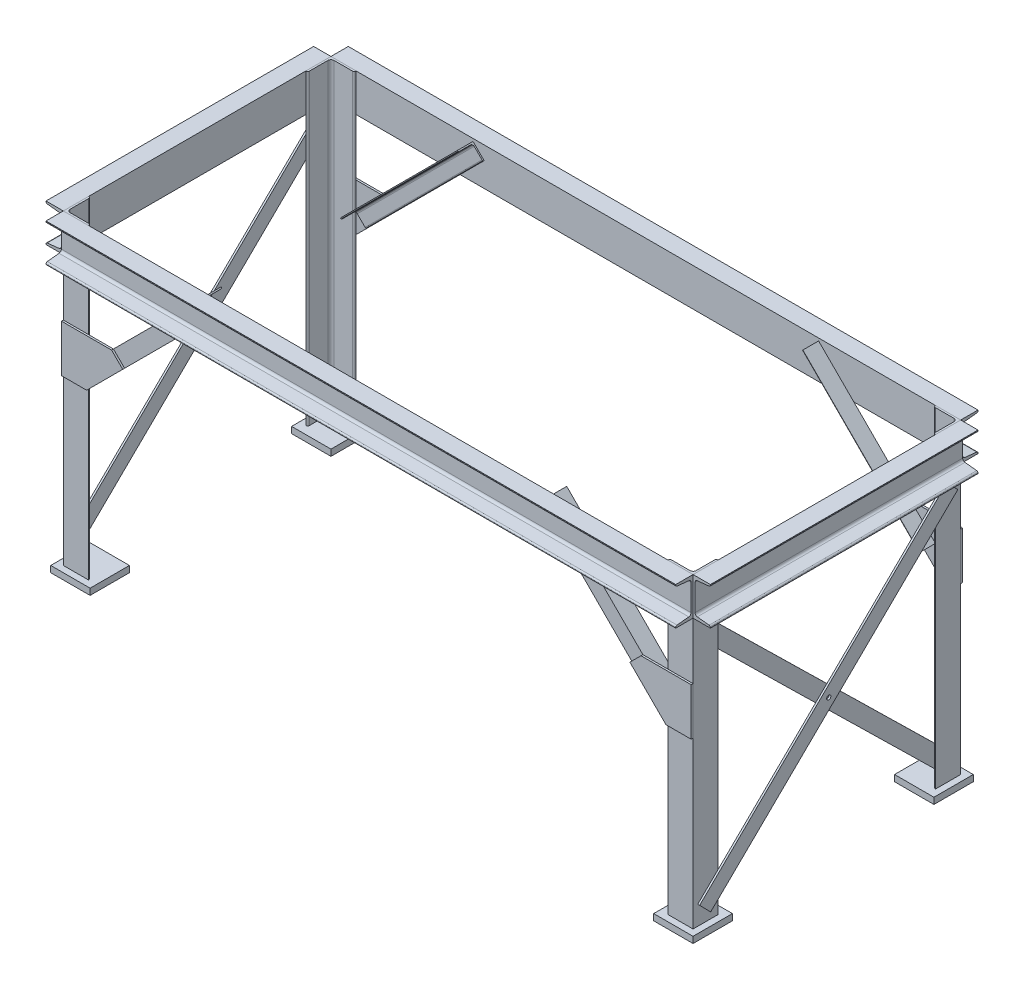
SolidWorks part; units mm, degrees
ref_plane "Front Plane" through (0, 0, 0) normal (0, 0, 1) x (1, 0, 0)
ref_plane "Top Plane" through (0, 0, 0) normal (0, 1, 0) x (1, 0, 0)
ref_plane "Right Plane" through (0, 0, 0) normal (1, 0, 0) x (0, 0, -1)
ref_plane "Top of Frame Plane" through (0, 1000, 0) normal (0, 1, 0) x (1, 0, 0)
sketch "Top of Frame Sketch" plane through (0, 1000, 0) normal (0, 1, 0) x (1, 0, 0)
  line L1 (1000, -425) -> (-1000, -425)
  line L2 (1000, -425) -> (1000, 425)
  line L3 (1000, 425) -> (-1000, 425)
  line L4 (-1000, -425) -> (-1000, 425)
  line L5 (1000, -425) -> (-1000, 425) construction
  line L6 (1000, 425) -> (-1000, -425) construction
  point P0 (0, 0)
  dimension "D1" = 2000
  dimension "D2" = 850
ref_plane "Leg Plane" through (0, 0, 425) normal (0, 0, 1) x (1, 0, 0)
sketch "Leg Sketch" plane through (0, 0, 425) normal (0, 0, 1) x (1, 0, 0)
  line L0 (-1000, 1000) -> (-1000, 25)
  dimension "D1" = 975
other "C channel CH 120 X 12(1)"
ref_plane "Plane3" through (1000, 880, 425) normal (-1, 0, 0) x (0, 0, 1)
sketch "Sketch1" plane through (1000, 880, 425) normal (-1, 0, 0) x (0, 0, 1)
  line L0 (55, 120) -> (0, 120)
  line L1 (55, 0) -> (0, 0)
  line L2 (0, 120) -> (0, 0)
  line L5 (0, 8.5) -> (30.8145, 8.5) construction
  line L6 (55, 120) -> (55, 118.1111)
  line L7 (55, 0) -> (55, 1.8889)
  line L12 (6.3, 101.7375) -> (6.3, 18.2625)
  line L17 (13.4638, 109.6937) -> (50.9704, 113.6358)
  line L18 (13.4638, 10.3063) -> (50.9704, 6.3642)
  arc A0 (50.9704, 113.6358) -> (55, 118.1111) centre (50.5, 118.1111) ccw
  arc A1 (50.9704, 6.3642) -> (55, 1.8889) centre (50.5, 1.8889) cw
  arc A9 (6.3, 18.2625) -> (13.4638, 10.3063) centre (14.3, 18.2625) ccw
  arc A10 (6.3, 101.7375) -> (13.4638, 109.6937) centre (14.3, 101.7375) cw
  point P10 (27.5, 120)
  point P11 (27.5, 0)
  point P12 (6.3, 60)
  point P13 (0, 60)
  point P14 (0, 0)
  dimension "RI" = 8
  dimension "D2" = 6
  dimension "RA" = 4.5
  dimension "D3" = 18.2625
  dimension "Depth" = 120
  dimension "BF" = 55
  dimension "TW" = 6.3
  dimension "TF" = 8.5
  dimension "d1" = 83.475
other "L angle (equal) 80X80X6(2)"
ref_plane "Plane4" through (-1000, 1000, 425) normal (0, -1, 0) x (0, 0, -1)
sketch "Sketch11" plane through (-1000, 1000, 425) normal (0, -1, 0) x (0, 0, -1)
  line L0 (0, 80) -> (0, 0)
  line L2 (6, 74) -> (6, 16)
  line L3 (16, 6) -> (74, 6)
  line L5 (80, 0) -> (0, 0)
  arc A0 (6, 74) -> (0, 80) centre (0, 74) ccw
  arc A1 (80, 0) -> (74, 6) centre (74, 0) ccw
  arc A2 (16, 6) -> (6, 16) centre (16, 16) cw
  point P8 (0, 40)
  point P9 (40, 0)
  point P10 (0, 0)
  dimension "Radius_2" = 6
  dimension "Radius_1" = 10
  dimension "V_leg" = 80
  dimension "H_leg" = 80
  dimension "thickness" = 6
sketch "Sketch12" plane through (0, 0, 425) normal (0, 0, 1) x (1, 0, 0)
  line L0 (-1000, 700) -> (-1000, 550)
  line L1 (-1000, 25) -> (-1000, 1000) construction
  line L2 (-1000, 550) -> (-920, 550)
  line L3 (-920, 25) -> (-920, 1000) construction
  line L4 (-920, 550) -> (-805.3553, 664.6447)
  line L5 (-805.3553, 664.6447) -> (-840.7107, 700)
  line L6 (-840.7107, 700) -> (-1000, 700)
  line L7 (-1055, 1000) -> (-1000, 1000) construction
  dimension "D1" = 150
  dimension "D2" = 45
  dimension "D3" = 50
  dimension "D4" = 450
extrude "Reinforcing Plate" add sketch "Sketch12" along normal blind 6 separate body
sketch "Angled Brace Sketch" plane through (0, 0, 425) normal (0, 0, -1) x (-1, 0, 0)
  line L0 (548.7689, 991.9417) -> (920, 620.7107)
  line L1 (920, 25) -> (920, 1000) construction
  line L3 (920, 550) -> (805.3553, 664.6447) construction
  dimension "D1" = 525
other "L angle (equal) 50X50X4(1)"
ref_plane "Plane5" through (-548.7689, 991.9417, 425) normal (-0.7071, -0.7071, 0) x (0, 0, -1)
sketch "Sketch14" plane through (-548.7689, 991.9417, 425) normal (-0.7071, -0.7071, 0) x (0, 0, -1)
  line L0 (0, 50) -> (0, 0)
  line L2 (4, 46) -> (4, 11)
  line L3 (11, 4) -> (46, 4)
  line L5 (50, 0) -> (0, 0)
  arc A0 (4, 46) -> (0, 50) centre (0, 46) ccw
  arc A1 (50, 0) -> (46, 4) centre (46, 0) ccw
  arc A2 (11, 4) -> (4, 11) centre (11, 11) cw
  point P8 (0, 25)
  point P9 (25, 0)
  point P10 (0, 0)
  dimension "Radius_2" = 4
  dimension "Radius_1" = 7
  dimension "V_leg" = 50
  dimension "H_leg" = 50
  dimension "thickness" = 4
sketch "Sketch15" plane through (0, 25, 0) normal (0, -1, 0) x (1, 0, 0)
  line L0 (-920, 425) -> (-1000, 425) construction
  line L1 (-1020, 445) -> (-895, 445)
  line L2 (-1020, 445) -> (-1020, 320)
  line L3 (-1020, 320) -> (-895, 320)
  line L4 (-895, 445) -> (-895, 320)
  line L5 (-1000, 425) -> (-1000, 345) construction
  point P6 (-960, 425)
  point P9 (-1000, 385)
  dimension "D1" = 125
  dimension "D2" = 125
  dimension "D3" = 20
  dimension "D4" = 20
extrude "Foot Plate" add sketch "Sketch15" along normal blind 20 separate body
mirror "Mirror1" about plane through (0, 0, 0) normal (0, 0, 1)
sketch "Sketch16" plane through (-1000, 0, 0) normal (-1, 0, 0) x (0, 0, 1)
  line L0 (-410, 819.289) -> (375.0039, 50)
  line L1 (-410, 819.289) -> (-375.0039, 855)
  line L2 (375.0039, 50) -> (410, 85.711)
  line L3 (-375.0039, 855) -> (410, 85.711)
  line L4 (425, 25) -> (425, 1000) construction
  line L5 (445, 25) -> (320, 25) construction
  line L6 (-425, 25) -> (-425, 1000) construction
  line L7 (-425, 880) -> (-480, 880) construction
  dimension "D1" = 50
  dimension "D2" = 15
  dimension "D3" = 25
  dimension "D4" = 15
  dimension "D5" = 25
extrude "Cross Brace 1" add sketch "Sketch16" along normal blind 6 separate body
sketch "Sketch17" plane through (-994, 0, 0) normal (1, 0, 0) x (0, 0, -1)
  line L0 (-410, 819.289) -> (375.0039, 50)
  line L1 (-410, 819.289) -> (-375.0039, 855)
  line L2 (375.0039, 50) -> (410, 85.711)
  line L3 (-375.0039, 855) -> (410, 85.711)
  line L4 (425, 880) -> (-425, 880) construction
  line L5 (-425, 25) -> (-425, 1000) construction
  line L6 (445, 25) -> (320, 25) construction
  line L7 (425, 25) -> (425, 1000) construction
  dimension "D1" = 50
  dimension "D2" = 25
  dimension "D3" = 15
  dimension "D4" = 25
  dimension "D5" = 15
extrude "Cross Brace 2" add sketch "Sketch17" along normal blind 6 separate body
hole_wizard "M12 Clearance Hole1" positions "Sketch18" profile "Sketch19" hole size "M12" standard "ANSI Metric"
sketch "Sketch18" plane through (-1006, 0, 0) normal (-1, 0, 0) x (0, 0, 1)
  line L0 (17.498, 470.3555) -> (-17.498, 434.6445) construction
  line L1 (410, 85.711) -> (-375.0039, 855) construction
  line L2 (-410, 819.289) -> (375.0039, 50) construction
  point P0 (0, 452.5)
sketch "Sketch19" plane through (-1006, 452.5, 0) normal (0, 1, 0) x (0, 0, 1)
  line L0 (0, 0) -> (0, 2061)
  line L1 (0, 2061) -> (6.75, 2061)
  line L2 (6.75, 2061) -> (6.75, 0)
  line L5 (6.75, 0) -> (0, 0)
  line L11 (0, -6.35) -> (0, 107.95) construction
  dimension "Thru Hole Dia." = 13.5
  dimension "Thru Hole Depth" = 2061
mirror "Mirror2" about plane through (0, 0, 0) normal (1, 0, 0)
